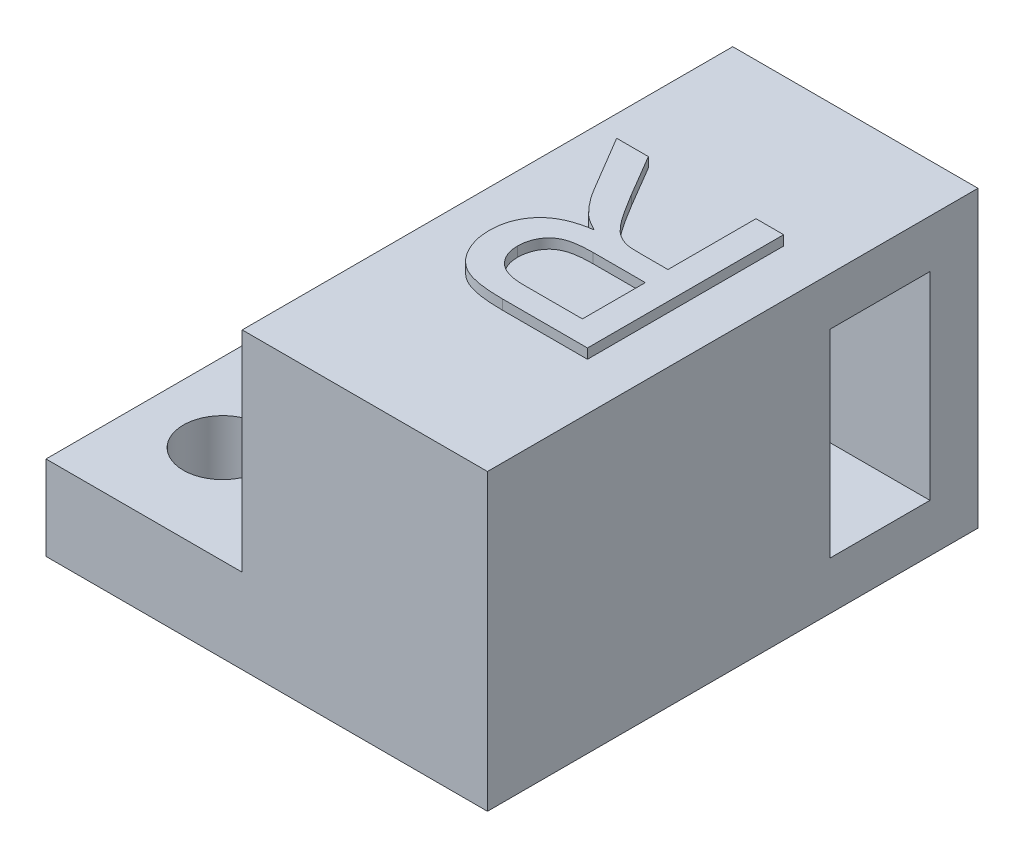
SolidWorks part; units mm, degrees
ref_plane "Спереди" through (0, 0, 0) normal (0, 0, 1) x (1, 0, 0)
ref_plane "Сверху" through (0, 0, 0) normal (0, 1, 0) x (1, 0, 0)
ref_plane "Справа" through (0, 0, 0) normal (1, 0, 0) x (0, 0, -1)
sketch "Sketch1" plane through (0, 0, 0) normal (0, 1, 0) x (1, 0, 0)
  line L1 (12.5, -25) -> (-12.5, -25)
  line L2 (12.5, -25) -> (12.5, 25)
  line L3 (12.5, 25) -> (-12.5, 25)
  line L4 (-12.5, -25) -> (-12.5, 25)
  line L5 (12.5, -25) -> (-12.5, 25) construction
  line L6 (12.5, 25) -> (-12.5, -25) construction
  point P0 (0, 0)
  dimension "D1" = 25
  dimension "D2" = 50
extrude "Boss-Extrude1" add sketch "Sketch1" along normal blind 30
sketch "Sketch2" plane through (-12.5, 0, 0) normal (-1, 0, 0) x (0, 0, 1)
  line L0 (-25, 4.3025) -> (25, 4.3025) construction
  line L1 (-25, 30) -> (-25, 0) construction
  line L2 (25, 30) -> (25, 0) construction
  line L4 (25, 8.605) -> (-25, 8.605)
  line L5 (25, 8.605) -> (25, 0)
  line L6 (25, 0) -> (-25, 0)
  line L7 (-25, 8.605) -> (-25, 0)
  line L8 (25, 8.605) -> (-25, 0) construction
  line L9 (25, 0) -> (-25, 8.605) construction
  point P6 (0, 4.3025)
extrude "Boss-Extrude2" add sketch "Sketch2" along normal blind 20
sketch "Sketch3" plane through (0, 8.605, 0) normal (0, 1, 0) x (1, 0, 0)
  line L0 (-24.5, -25) -> (-24.5, 25) construction
  line L1 (-32.5, 25) -> (-12.5, 25) construction
  line L2 (-32.5, -25) -> (-12.5, -25) construction
  circle A0 centre (-24.5, 15) radius 4
  circle A1 centre (-24.5, -15) radius 4
  dimension "D1" = 8
  dimension "D2" = 8
  dimension "D3" = 10
  dimension "D4" = 10
extrude "Cut-Extrude1" cut sketch "Sketch3" against normal through all
sketch "Sketch4" plane through (12.5, 0, 0) normal (1, 0, 0) x (0, 0, -1)
  line L0 (15, 30) -> (15, 0) construction
  line L3 (-25, 30) -> (25, 30) construction
  line L4 (20.1, 4.9) -> (9.9, 4.9)
  line L5 (20.1, 4.9) -> (20.1, 25.1)
  line L6 (20.1, 25.1) -> (9.9, 25.1)
  line L7 (9.9, 4.9) -> (9.9, 25.1)
  line L8 (20.1, 4.9) -> (9.9, 25.1) construction
  line L9 (20.1, 25.1) -> (9.9, 4.9) construction
  line L10 (-25, 0) -> (25, 0) construction
  line L11 (25, 30) -> (25, 0) construction
  point P6 (15, 15)
  point P13 (15, 15)
  dimension "D1" = 20.2
  dimension "D2" = 10.2
  dimension "D3" = 10
extrude "Cut-Extrude2" cut sketch "Sketch4" against normal blind 20
sketch "Sketch5" plane through (0, 30, 0) normal (0, 1, 0) x (1, 0, 0)
  line L0 (12.5, 10) -> (-12.5, 10) construction
  line L1 (12.5, -25) -> (12.5, 25) construction
  line L2 (-12.5, 25) -> (-12.5, -25) construction
  line L3 (12.5, 25) -> (-12.5, 25) construction
  text T0 "R" font "Arial" height 20
  dimension "D1" = 15
extrude "Boss-Extrude3" add sketch "Sketch5" along normal blind 1
